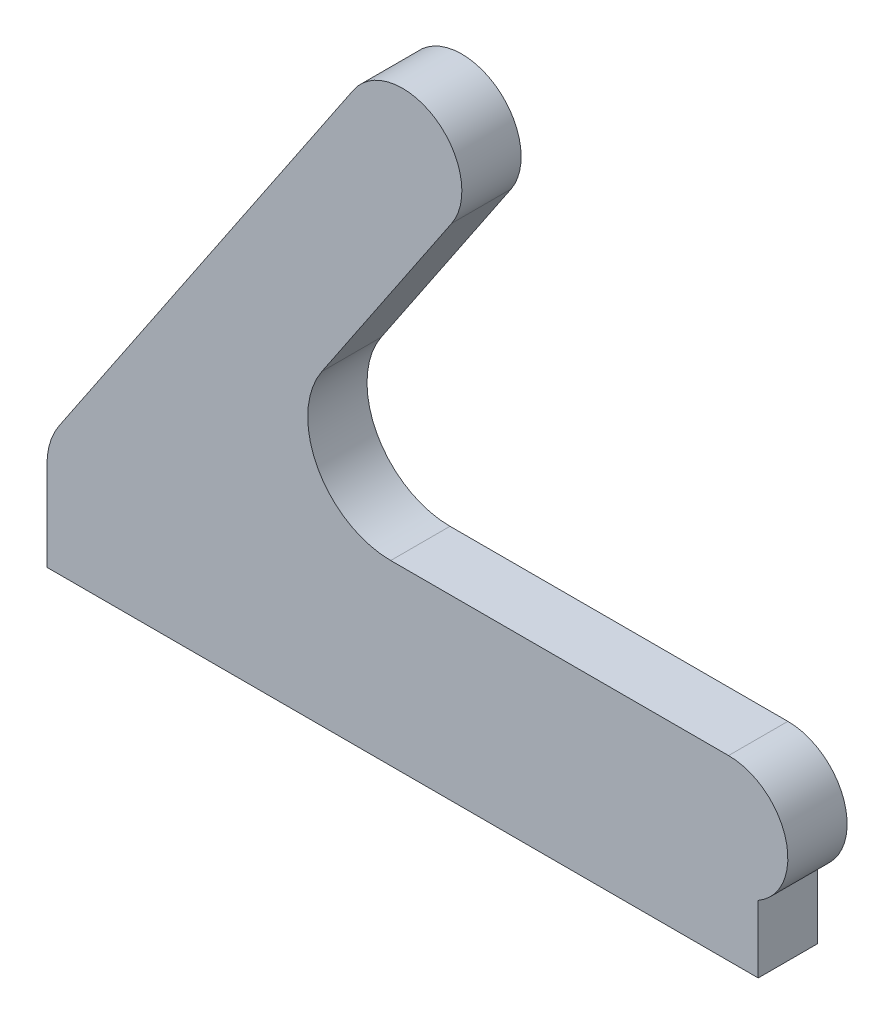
SolidWorks part; units mm, degrees
ref_plane "Plan de face" through (0, 0, 0) normal (0, 0, 1) x (1, 0, 0)
ref_plane "Plan de dessus" through (0, 0, 0) normal (0, 1, 0) x (1, 0, 0)
ref_plane "Plan de droite" through (0, 0, 0) normal (1, 0, 0) x (0, 0, -1)
sketch "Esquisse1" plane through (0, 0, 0) normal (0, 0, 1) x (1, 0, 0)
  line L0 (0, 0) -> (120, 0)
  line L1 (120, 0) -> (120, 11.3397)
  line L2 (0, 0) -> (0, 15)
  line L3 (2.0406, 21.694) -> (51.7005, 95.5784)
  line L4 (68.2995, 84.4216) -> (46.38, 51.8097)
  line L5 (115, 30) -> (57.9994, 30)
  arc A0 (51.7005, 95.5784) -> (68.2995, 84.4216) centre (60, 90) cw
  arc A1 (120, 11.3397) -> (115, 30) centre (115, 20) ccw
  arc A2 (46.38, 51.8097) -> (57.9994, 30) centre (57.9994, 44) ccw
  arc A3 (0, 15) -> (2.0406, 21.694) centre (12, 15) cw
  dimension "D5" = 12
  dimension "D7" = 14
  dimension "D8" = 10
  dimension "D1" = 120
  dimension "D2" = 115
  dimension "D3" = 20
  dimension "D4" = 30
  dimension "D6" = 15
  dimension "D9" = 60
  dimension "D10" = 90
extrude "Boss.-Extru.1" add sketch "Esquisse1" along normal blind 10
